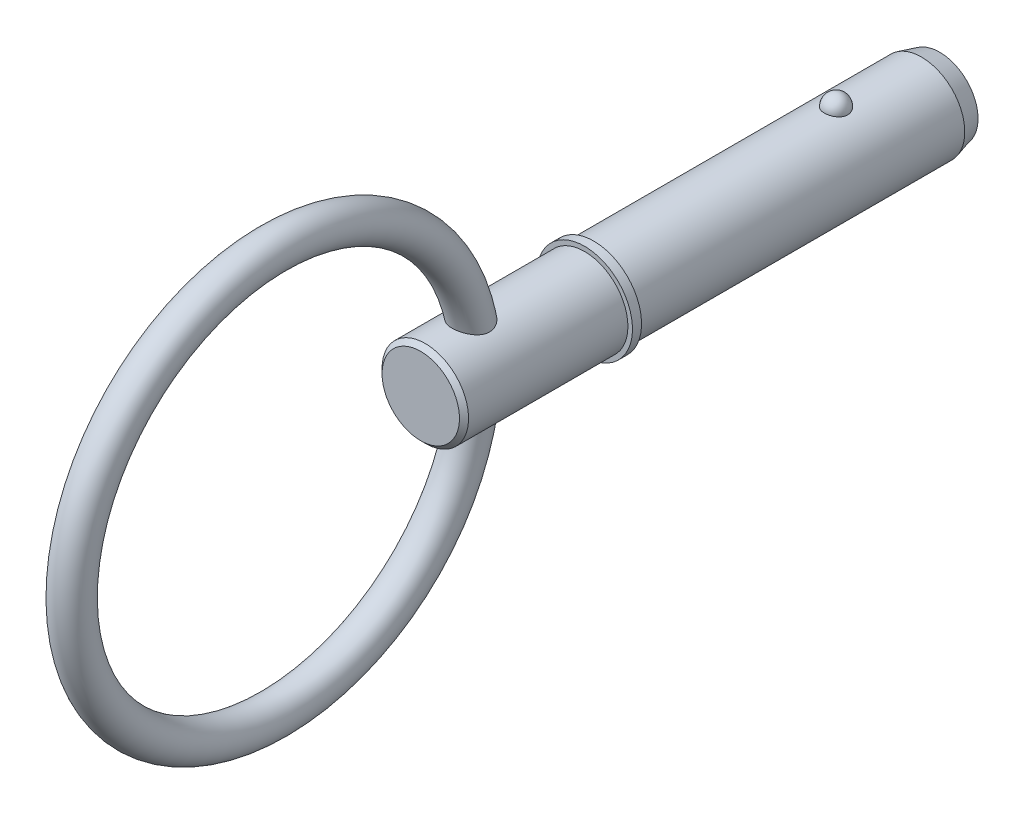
SolidWorks part; units mm, degrees
ref_plane "Front Plane" through (0, 0, 0) normal (0, 0, 1) x (1, 0, 0)
ref_plane "Top Plane" through (0, 0, 0) normal (0, 1, 0) x (1, 0, 0)
ref_plane "Right Plane" through (0, 0, 0) normal (1, 0, 0) x (0, 0, -1)
sketch "Sketch2" plane through (0, 0, 0) normal (0, 0, 1) x (1, 0, 0)
  circle A0 centre (0, 0) radius 4.765
  point P3 (0, 4.765)
  dimension "D1" = 9.53
extrude "Boss-Extrude1" add sketch "Sketch2" along normal blind 25.4
sketch "Sketch3" plane through (0, 0, 0) normal (0, 0, -1) x (-1, 0, 0)
  circle A0 centre (0, 0) radius 4.765
  dimension "D1" = 9.53
extrude "Boss-Extrude2" add sketch "Sketch3" along normal blind 12.7
chamfer "Chamfer1" distance 2 angle 15 1 edges at (-4.765, 0, -12.7)
sketch "Sketch18" plane through (0, 0, 0) normal (1, 0, 0) x (0, 0, -1)
  line L0 (10.7, 4.765) -> (-25.4, 4.765) construction
  line L1 (1.29, 6.055) -> (1.29, 3.475)
  line L2 (-25.4, -4.765) -> (10.7, -4.765) construction
  arc A0 (1.29, 6.055) -> (1.29, 3.475) centre (1.29, 4.765) ccw
  point P4 (0, 4.765)
  dimension "D1" = 10.82
revolve "Revolve1" add sketch "Sketch18" angle 360 about L1
sketch "Sketch19" plane through (0, 0, 0) normal (1, 0, 0) x (0, 0, -1)
  line L0 (-33.7288, 0) -> (-46.4542, 0) construction
sketch "Sketch20" plane through (0, 0, 0) normal (1, 0, 0) x (0, 0, -1)
  line L0 (-25.4, 0) -> (-25.4, 5.265)
  line L1 (-25.4, 4.765) -> (-25.4, -4.765) construction
  line L2 (-25.4, 5.265) -> (-26.4, 5.265)
  line L3 (-26.4, 5.265) -> (-26.4, 0)
  line L4 (-33.7288, 0) -> (-46.4542, 0) construction
  line L5 (-26.4, 0) -> (-25.4, 0)
  dimension "D1" = 5.265
  dimension "D2" = 1
revolve "Revolve2" add sketch "Sketch20" angle 360 about L0
sketch "Sketch21" plane through (0, 0, 25.4) normal (0, 0, -1) x (-1, 0, 0)
  circle A0 centre (0, 0) radius 4.765
  dimension "D1" = 9.53
extrude "Boss-Extrude3" add sketch "Sketch21" against normal blind 19.05
chamfer "Chamfer2" distance 0.5 angle 45 1 edges at (-4.765, 0, 44.45)
sketch "Sketch23" plane through (0, 0, 0) normal (1, 0, 0) x (0, 0, -1)
  line L0 (-44.45, 4.265) -> (-44.45, -4.265) construction
  circle A0 centre (-60.675, 0) radius 22.225
  point P2 (-38.45, 0)
  dimension "D1" = 44.45
  dimension "D2" = 6
sketch "Sketch24" plane through (0, 0, 0) normal (0, 1, 0) x (1, 0, 0)
  circle A0 centre (0, -38.45) radius 2
  dimension "D1" = 4
sweep "Sweep1" add profiles "Sketch24" path "Sketch23"
